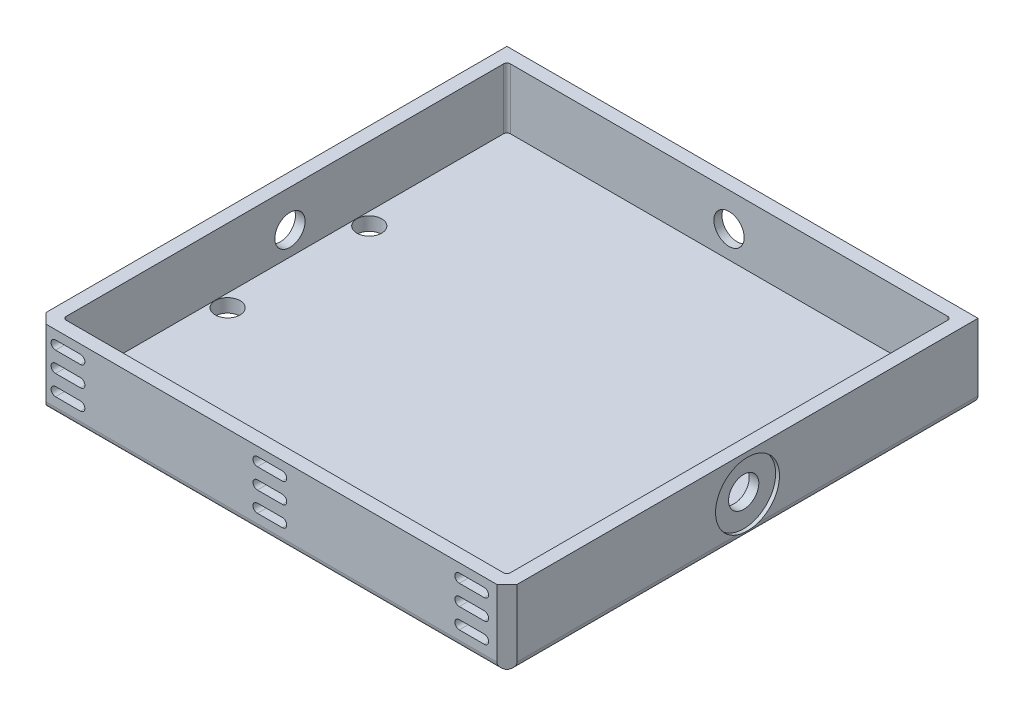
SolidWorks part; units mm, degrees
ref_plane "Front Plane" through (0, 0, 0) normal (0, 0, 1) x (1, 0, 0)
ref_plane "Top Plane" through (0, 0, 0) normal (0, 1, 0) x (1, 0, 0)
ref_plane "Right Plane" through (0, 0, 0) normal (1, 0, 0) x (0, 0, -1)
sketch "Sketch1" plane through (0, 0, 0) normal (0, 1, 0) x (1, 0, 0)
  line L1 (-88.9, 177.8) -> (88.9, 177.8)
  line L2 (-88.9, 177.8) -> (-88.9, 0)
  line L3 (-88.9, 0) -> (88.9, 0)
  line L4 (88.9, 177.8) -> (88.9, 0)
  line L5 (-83.82, 172.72) -> (83.82, 172.72)
  line L6 (-83.82, 172.72) -> (-83.82, 5.08)
  line L7 (-83.82, 5.08) -> (83.82, 5.08)
  line L8 (83.82, 172.72) -> (83.82, 5.08)
  point P4 (0, 0)
  dimension "D1" = 177.8
  dimension "D2" = 177.8
  dimension "D3" = 5.08
  dimension "D4" = 5.08
  dimension "D5" = 5.08
  dimension "D6" = 5.08
extrude "Boss-Extrude1" add sketch "Sketch1" along normal blind 27.94
sketch "Sketch2" plane through (0, 0, 0) normal (0, 1, 0) x (1, 0, 0)
  line L1 (-88.9, 177.8) -> (88.9, 177.8)
  line L2 (-88.9, 177.8) -> (-88.9, 0)
  line L3 (-88.9, 0) -> (88.9, 0)
  line L4 (88.9, 177.8) -> (88.9, 0)
extrude "Boss-Extrude2" add sketch "Sketch2" along normal blind 5.08
chamfer "Chamfer1" distance 3.81 angle 45 2 edges at (-88.9, 13.97, 0) (88.9, 13.97, 0)
fillet "Fillet1" radius 2.54 4 edges at (0, 0, 0) (-88.9, 0, -90.805) (0, 0, -177.8) (88.9, 0, -90.805)
sketch "Sketch3" plane through (88.9, 0, 0) normal (1, 0, 0) x (0, 0, -1)
  line L0 (3.81, 27.94) -> (177.8, 27.94) construction
  circle A0 centre (90.805, 13.97) radius 5.715
  point P4 (90.805, 27.94)
  dimension "D2" = 11.43
  dimension "D1" = 13.97
extrude "Cut-Extrude1" cut sketch "Sketch3" against normal through all
sketch "Sketch4" plane through (0, 0, 0) normal (0, 0, 1) x (1, 0, 0)
  line L0 (-81.4926, 7.6735) -> (-72.0859, 7.6735) construction
  line L1 (-81.4926, 9.3425) -> (-72.0859, 9.3425)
  line L2 (-81.4926, 6.0046) -> (-72.0859, 6.0046)
  line L3 (86.36, 0) -> (-86.36, 0) construction
  line L4 (-88.9, 2.54) -> (-88.9, 27.94) construction
  line L5 (-5.2926, 6.0046) -> (4.1141, 6.0046)
  line L6 (-5.2926, 9.3425) -> (4.1141, 9.3425)
  line L7 (-5.2926, 7.6735) -> (4.1141, 7.6735) construction
  line L8 (70.9074, 6.0046) -> (80.3141, 6.0046)
  line L9 (70.9074, 9.3425) -> (80.3141, 9.3425)
  line L10 (70.9074, 7.6735) -> (80.3141, 7.6735) construction
  line L11 (-5.2926, 13.6246) -> (4.1141, 13.6246)
  line L12 (-5.2926, 16.9625) -> (4.1141, 16.9625)
  line L13 (-5.2926, 15.2935) -> (4.1141, 15.2935) construction
  line L14 (70.9074, 13.6246) -> (80.3141, 13.6246)
  line L15 (70.9074, 16.9625) -> (80.3141, 16.9625)
  line L16 (70.9074, 15.2935) -> (80.3141, 15.2935) construction
  line L17 (-5.2926, 21.2446) -> (4.1141, 21.2446)
  line L18 (-5.2926, 24.5825) -> (4.1141, 24.5825)
  line L19 (-5.2926, 22.9135) -> (4.1141, 22.9135) construction
  line L20 (70.9074, 21.2446) -> (80.3141, 21.2446)
  line L21 (70.9074, 24.5825) -> (80.3141, 24.5825)
  line L22 (70.9074, 22.9135) -> (80.3141, 22.9135) construction
  line L23 (-81.4926, 13.6246) -> (-72.0859, 13.6246)
  line L24 (-81.4926, 16.9625) -> (-72.0859, 16.9625)
  line L25 (-81.4926, 15.2935) -> (-72.0859, 15.2935) construction
  line L26 (-81.4926, 21.2446) -> (-72.0859, 21.2446)
  line L27 (-81.4926, 24.5825) -> (-72.0859, 24.5825)
  line L28 (-81.4926, 22.9135) -> (-72.0859, 22.9135) construction
  arc A0 (-81.4926, 9.3425) -> (-81.4926, 6.0046) centre (-81.4926, 7.6735) ccw
  arc A1 (-72.0859, 6.0046) -> (-72.0859, 9.3425) centre (-72.0859, 7.6735) ccw
  arc A2 (-5.2926, 9.3425) -> (-5.2926, 6.0046) centre (-5.2926, 7.6735) ccw
  arc A3 (4.1141, 6.0046) -> (4.1141, 9.3425) centre (4.1141, 7.6735) ccw
  arc A4 (70.9074, 9.3425) -> (70.9074, 6.0046) centre (70.9074, 7.6735) ccw
  arc A5 (80.3141, 6.0046) -> (80.3141, 9.3425) centre (80.3141, 7.6735) ccw
  arc A6 (-5.2926, 16.9625) -> (-5.2926, 13.6246) centre (-5.2926, 15.2935) ccw
  arc A7 (4.1141, 13.6246) -> (4.1141, 16.9625) centre (4.1141, 15.2935) ccw
  arc A8 (70.9074, 16.9625) -> (70.9074, 13.6246) centre (70.9074, 15.2935) ccw
  arc A9 (80.3141, 13.6246) -> (80.3141, 16.9625) centre (80.3141, 15.2935) ccw
  arc A10 (-5.2926, 24.5825) -> (-5.2926, 21.2446) centre (-5.2926, 22.9135) ccw
  arc A11 (4.1141, 21.2446) -> (4.1141, 24.5825) centre (4.1141, 22.9135) ccw
  arc A12 (70.9074, 24.5825) -> (70.9074, 21.2446) centre (70.9074, 22.9135) ccw
  arc A13 (80.3141, 21.2446) -> (80.3141, 24.5825) centre (80.3141, 22.9135) ccw
  arc A14 (-81.4926, 16.9625) -> (-81.4926, 13.6246) centre (-81.4926, 15.2935) ccw
  arc A15 (-72.0859, 13.6246) -> (-72.0859, 16.9625) centre (-72.0859, 15.2935) ccw
  arc A16 (-81.4926, 24.5825) -> (-81.4926, 21.2446) centre (-81.4926, 22.9135) ccw
  arc A17 (-72.0859, 21.2446) -> (-72.0859, 24.5825) centre (-72.0859, 22.9135) ccw
  point P2 (-76.7893, 7.6735)
  point P16 (-0.5893, 7.6735)
  point P23 (75.6107, 7.6735)
  point P30 (-0.5893, 15.2935)
  point P37 (75.6107, 15.2935)
  point P44 (-0.5893, 22.9135)
  point P51 (75.6107, 22.9135)
  point P58 (-76.7893, 15.2935)
  point P65 (-76.7893, 22.9135)
  dimension "D3" = 9.4068
  dimension "D4" = 7.4074
  dimension "D1" = 7.6735
  dimension "D2" = 3.3379
  dimension "D7" = 76.2
  dimension "D5" = 3
  dimension "D6" = 3
extrude "Cut-Extrude2" cut sketch "Sketch4" against normal up to surface (5.08 mm away)
sketch "Sketch5" plane through (0, 0, 0) normal (0, -1, 0) x (1, 0, 0)
  line L1 (-79.0228, -62.4874) -> (78.8209, -62.4874) construction
  line L2 (-79.0228, -62.4874) -> (-79.0228, -115.9631) construction
  line L3 (-79.0228, -115.9631) -> (78.8209, -115.9631) construction
  line L4 (78.8209, -62.4874) -> (78.8209, -115.9631) construction
  line L5 (-79.0228, -62.4874) -> (78.8209, -115.9631) construction
  line L6 (-79.0228, -115.9631) -> (78.8209, -62.4874) construction
  circle A0 centre (-79.0228, -62.4874) radius 4.699
  circle A1 centre (-79.0228, -115.9631) radius 4.699
  circle A2 centre (78.8209, -62.4874) radius 4.699
  circle A3 centre (78.8209, -115.9631) radius 4.699
  point P11 (-0.1009, -89.2253)
  dimension "D1" = 9.398
extrude "Cut-Extrude3" cut sketch "Sketch5" against normal blind 10.16 contours A2 | A3 | A1 | A0
sketch "Sketch6" plane through (88.9, 0, 0) normal (1, 0, 0) x (0, 0, -1)
  circle A2 centre (90.805, 13.97) radius 12.065
  dimension "D1" = 24.13
extrude "Cut-Extrude4" cut sketch "Sketch6" against normal blind 1.4478
sketch "Sketch8" plane through (-88.9, 0, 0) normal (-1, 0, 0) x (0, 0, 1)
  circle A0 centre (-90.805, 13.97) radius 12.192
  dimension "D1" = 24.384
extrude "Cut-Extrude5" cut sketch "Sketch8" against normal blind 1.4478
sketch "Sketch9" plane through (0, 0, -177.8) normal (0, 0, -1) x (-1, 0, 0)
  circle A0 centre (-0.0029, 15.24) radius 5.715
  dimension "D1" = 11.43
extrude "Cut-Extrude6" cut sketch "Sketch9" against normal up to surface (5.08 mm away)
sketch "Sketch10" plane through (0, 0, -177.8) normal (0, 0, -1) x (-1, 0, 0)
  circle A0 centre (-0.0029, 15.24) radius 12.065
  dimension "D1" = 24.13
extrude "Cut-Extrude7" cut sketch "Sketch10" against normal blind 2.032
fillet "Fillet2" radius 1.27 4 edges at (-83.82, 16.51, -172.72) (-83.82, 16.51, -5.08) (83.82, 16.51, -5.08) (83.82, 16.51, -172.72)
